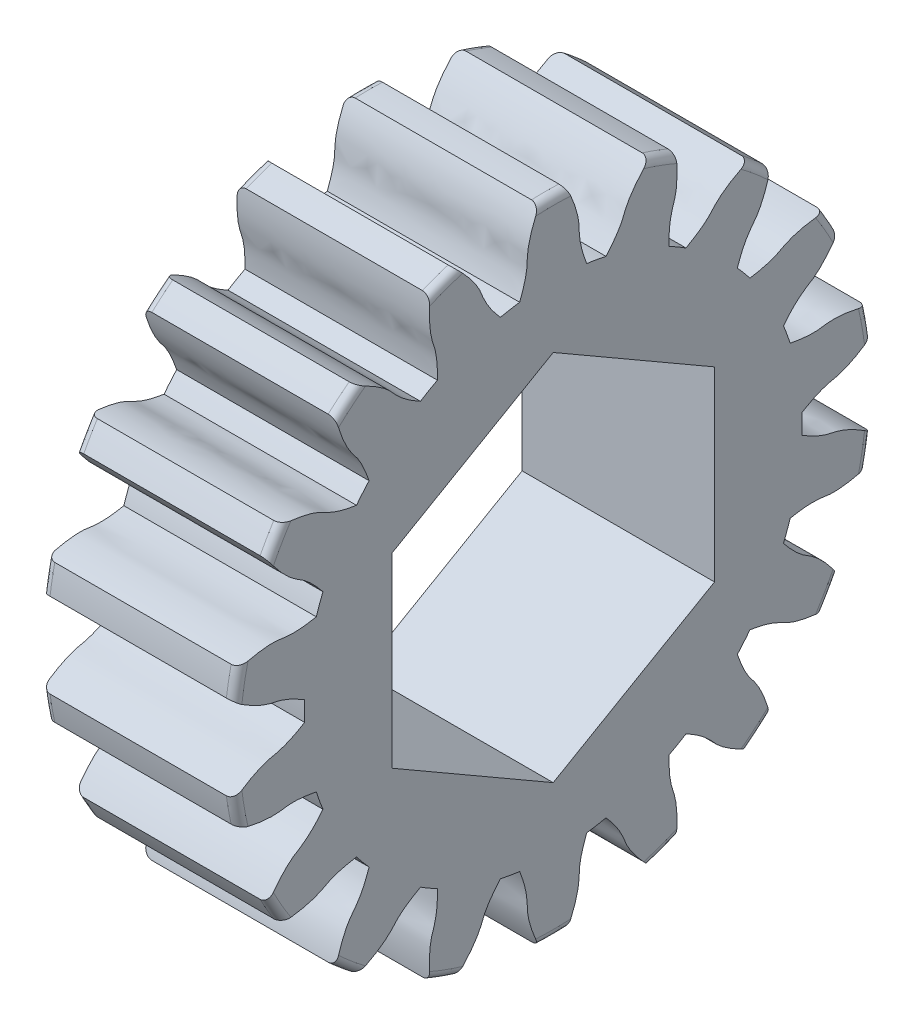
SolidWorks part; units mm, degrees
ref_plane "Front Plane" through (0, 0, 0) normal (0, 0, 1) x (1, 0, 0)
ref_plane "Top Plane" through (0, 0, 0) normal (0, 1, 0) x (1, 0, 0)
ref_plane "Right Plane" through (0, 0, 0) normal (1, 0, 0) x (0, 0, -1)
ref_plane "Plane1" through (2.3749, 0, 0) normal (1, 0, 0) x (0, 0, -1)
sketch "Sketch1" plane through (2.3749, 0, 0) normal (1, 0, 0) x (0, 0, -1)
  arc A1 (-0.8275, 6.0844) -> (4.5449, 4.1291) centre (0, 0) ccw construction
  circle A2 centre (0, 0) radius 7.9375
  spline S0 degree 3 poles (4.5449, 4.1291) (4.5665, 4.1879) (4.5875, 4.247) (4.6099, 4.3056) (4.6889, 4.513) (4.7942, 4.7155) (4.9365, 4.8859) (5.0829, 5.0611) (5.1764, 5.2784) (5.2518, 5.4939) (5.2688, 5.5423) (5.2844, 5.5912) (5.2989, 5.6404) (5.3202, 5.7123) (5.3391, 5.7849) (5.3561, 5.858) knots -0.000186 -0.000186 -0.000186 -0.000186 0 0 0 0.000666 0.000666 0.000666 0.001356 0.001356 0.001356 0.001509 0.001509 0.001509 0.001734 0.001734 0.001734 0.001734 construction
  spline S1 degree 3 poles (-0.3376, 7.9303) (-0.3715, 7.8634) (-0.4037, 7.7956) (-0.4336, 7.7269) (-0.4974, 7.5807) (-0.5503, 7.429) (-0.5888, 7.2742) (-0.621, 7.1449) (-0.6413, 7.0111) (-0.641, 6.8779) (-0.6405, 6.7001) (-0.6813, 6.5226) (-0.7338, 6.3528) (-0.7433, 6.3222) (-0.7533, 6.2917) (-0.7638, 6.2614) (-0.7844, 6.2022) (-0.8062, 6.1434) (-0.8275, 6.0844) knots -0.000224 -0.000224 -0.000224 -0.000224 0 0 0 0.000479 0.000479 0.000479 0.000879 0.000879 0.000879 0.001418 0.001418 0.001418 0.001514 0.001514 0.001514 0.001703 0.001703 0.001703 0.001703 construction
extrude "Boss-Extrude1" add sketch "Sketch1" against normal blind 4.7498
sketch "Sketch2" plane through (-2.3749, 0, 0) normal (-1, 0, 0) x (0, 0, 1)
  arc A0 (-3.0296, 7.3366) -> (-4.8389, 6.292) centre (0, 0) ccw
  arc A1 (-3.2771, 5.1928) -> (-2.8586, 5.4345) centre (0, 0) cw
  spline S0 degree 3 poles (-4.8389, 6.292) (-4.7699, 6.2626) (-4.7017, 6.2313) (-4.6346, 6.1979) (-4.4917, 6.1268) (-4.3537, 6.0446) (-4.2247, 5.9508) (-4.1169, 5.8725) (-4.0154, 5.783) (-3.93, 5.6808) (-3.8161, 5.5443) (-3.6707, 5.4345) (-3.5214, 5.3382) (-3.4944, 5.3208) (-3.4672, 5.3039) (-3.4397, 5.2875) (-3.3858, 5.2553) (-3.3313, 5.2243) (-3.2771, 5.1928) knots -0.000224 -0.000224 -0.000224 -0.000224 0 0 0 0.000479 0.000479 0.000479 0.000879 0.000879 0.000879 0.001418 0.001418 0.001418 0.001514 0.001514 0.001514 0.001703 0.001703 0.001703 0.001703
  spline S1 degree 3 poles (-2.8586, 5.4345) (-2.8587, 5.4972) (-2.8583, 5.5599) (-2.8593, 5.6226) (-2.8626, 5.8445) (-2.8923, 6.0709) (-2.9678, 6.2796) (-3.0454, 6.4943) (-3.0589, 6.7305) (-3.0561, 6.9588) (-3.0555, 7.0101) (-3.0534, 7.0614) (-3.0502, 7.1126) (-3.0456, 7.1874) (-3.0386, 7.2622) (-3.0296, 7.3366) knots -0.000186 -0.000186 -0.000186 -0.000186 0 0 0 0.000666 0.000666 0.000666 0.001356 0.001356 0.001356 0.001509 0.001509 0.001509 0.001734 0.001734 0.001734 0.001734
extrude "Cut-Extrude1" cut sketch "Sketch2" against normal through all
sketch "Sketch3" plane through (-2.3749, 0, 0) normal (-1, 0, 0) x (0, 0, 1)
  arc A0 (-0.3376, 7.9303) -> (-2.3951, 7.5675) centre (0, 0) ccw
  arc A1 (-1.3034, 6.0005) -> (-0.8275, 6.0844) centre (0, 0) cw
  spline S0 degree 3 poles (-2.3951, 7.5675) (-2.3403, 7.5163) (-2.2869, 7.4636) (-2.2353, 7.4092) (-2.1254, 7.2936) (-2.0237, 7.1692) (-1.9346, 7.0369) (-1.8601, 6.9264) (-1.7953, 6.8076) (-1.7501, 6.6823) (-1.6897, 6.5152) (-1.5906, 6.3623) (-1.4832, 6.2206) (-1.4638, 6.1951) (-1.444, 6.1699) (-1.4238, 6.145) (-1.3842, 6.0964) (-1.3436, 6.0486) (-1.3034, 6.0005) knots -0.000224 -0.000224 -0.000224 -0.000224 0 0 0 0.000479 0.000479 0.000479 0.000879 0.000879 0.000879 0.001418 0.001418 0.001418 0.001514 0.001514 0.001514 0.001703 0.001703 0.001703 0.001703
  spline S1 degree 3 poles (-0.8275, 6.0844) (-0.8062, 6.1434) (-0.7844, 6.2022) (-0.7638, 6.2614) (-0.691, 6.4711) (-0.6415, 6.694) (-0.641, 6.916) (-0.6405, 7.1443) (-0.5725, 7.3708) (-0.4917, 7.5844) (-0.4736, 7.6324) (-0.4541, 7.6799) (-0.4336, 7.7269) (-0.4037, 7.7956) (-0.3715, 7.8634) (-0.3376, 7.9303) knots -0.000186 -0.000186 -0.000186 -0.000186 0 0 0 0.000666 0.000666 0.000666 0.001356 0.001356 0.001356 0.001509 0.001509 0.001509 0.001734 0.001734 0.001734 0.001734
extrude "Cut-Extrude2" [suppressed] cut sketch "Sketch3" against normal through all
hole_wizard "M4 Clearance Hole1" positions "Sketch5" profile "Sketch4" hole size "M4" standard "ANSI Metric"
sketch "Sketch5" plane through (2.3749, 0, 0) normal (1, 0, 0) x (0, 0, -1)
  point P0 (0, 0)
sketch "Sketch4" plane through (2.3749, 0, 0) normal (0, 1, 0) x (0, 0, -1)
  line L0 (0, 0) -> (0, 4.7498)
  line L1 (0, 4.7498) -> (2.3749, 4.7498)
  line L2 (2.3749, 4.7498) -> (2.3749, 0)
  line L5 (2.3749, 0) -> (0, 0)
  line L11 (0, -6.35) -> (0, 107.95) construction
  dimension "Thru Hole Dia." = 4.7498
  dimension "Thru Hole Depth" = 4.7498
chamfer "Chamfer1" distance 0.1781 angle 45 2 edges at (-2.3749, 0, -2.3749) (2.3749, 0, -2.3749)
fillet "Fillet1" radius 0.1984 2 edges at (2.3749, -6.8741, 3.9687) (-2.3749, -6.8741, 3.9687)
fillet "Fillet2" [suppressed] radius 0.3096
pattern_circular "CirPattern1" count 18 over 360 about axis through (2.3749, 0, 0) along (1, 0, 0) of "Cut-Extrude1"
sketch "Sketch6" plane through (2.3749, 0, 0) normal (1, 0, 0) x (0, 0, -1)
  line L0 (0, -4.5974) -> (0, 0) construction
  line L1 (0, -4.5974) -> (3.9815, -2.2987)
  line L2 (3.9815, -2.2987) -> (3.9815, 2.2987)
  line L3 (3.9815, 2.2987) -> (0, 4.5974)
  line L4 (0, 4.5974) -> (-3.9814, 2.2987)
  line L5 (-3.9814, 2.2987) -> (-3.9815, -2.2987)
  line L6 (-3.9815, -2.2987) -> (0, -4.5974)
  circle A1 centre (0, 0) radius 3 construction
  circle A2 centre (0, 0) radius 3.9815 construction
  dimension "D2" = 6
  dimension "D3" = 7.9629
extrude "Cut-Extrude3" cut sketch "Sketch6" against normal through all
chamfer "Chamfer2" [suppressed] distance 0.127 angle 45
